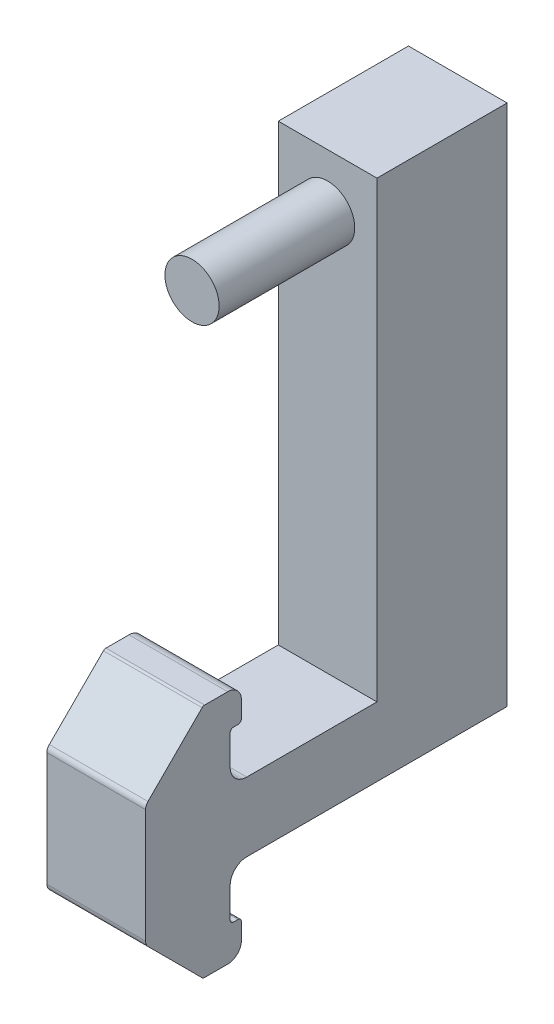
SolidWorks part; units mm, degrees
ref_plane "Front Plane" through (0, 0, 0) normal (0, 0, 1) x (1, 0, 0)
ref_plane "Top Plane" through (0, 0, 0) normal (0, 1, 0) x (1, 0, 0)
ref_plane "Right Plane" through (0, 0, 0) normal (1, 0, 0) x (0, 0, -1)
sketch "Sketch1" plane through (0, 0, 0) normal (0, 0, 1) x (1, 0, 0)
  circle A0 centre (0, 0) radius 2.5
  dimension "D1" = 5
extrude "Boss-Extrude1" add sketch "Sketch1" along normal blind 12.5 contours A0
sketch "Sketch2" plane through (0, 0, 0) normal (0, 0, -1) x (-1, 0, 0)
  line L0 (0, 0) -> (-4.5466, 0) construction
  line L1 (-4.5466, 0) -> (-4.5466, 5)
  line L2 (-4.5466, 5) -> (4.5466, 5)
  line L3 (4.5466, 5) -> (4.5466, 0)
  line L4 (4.5466, 0) -> (0, 0) construction
  line L5 (-4.5466, 0) -> (-4.5466, -40)
  line L6 (-4.5466, -40) -> (4.5466, -40)
  line L7 (4.5466, 0) -> (4.5466, -40)
  circle A0 centre (0, 0) radius 2.5 construction
  dimension "D1" = 5
  dimension "D2" = 40
extrude "Boss-Extrude2" add sketch "Sketch2" along normal blind 12
sketch "Sketch4" plane through (4.5466, 0, 0) normal (1, 0, 0) x (0, 0, -1)
  line L0 (-16.1163, -29.2187) -> (-21.1087, -34.2112)
  line L1 (-15.89, -50.875) -> (-13.76, -50.875)
  line L2 (-21.3319, -34.75) -> (-21.3319, -45.25)
  line L3 (-21.1087, -45.7888) -> (-16.1163, -50.7813)
  line L6 (0, -40) -> (-21.3319, -40) construction
  line L7 (-15.89, -29.125) -> (-13.76, -29.125)
  line L8 (-12.49, -30.395) -> (-12.49, -31.895)
  line L9 (-12.81, -32.215) -> (-13.21, -32.215)
  line L10 (-13.53, -32.535) -> (-13.53, -35.285)
  line L11 (-12, -36.815) -> (0, -36.815)
  line L12 (0, 5) -> (0, -40) construction
  line L13 (-12.49, -49.605) -> (-12.49, -48.105)
  line L14 (-12, -43.185) -> (0, -43.185)
  line L15 (-13.53, -47.465) -> (-13.53, -44.715)
  line L16 (-12.81, -47.785) -> (-13.21, -47.785)
  line L17 (0, -40) -> (0, -36.815)
  line L18 (0, -43.185) -> (12, -43.185)
  line L19 (12, -43.185) -> (12, -40)
  line L20 (12, -40) -> (0, -40)
  line L21 (0, -40) -> (0, -43.185) construction
  arc A0 (-21.1087, -45.7888) -> (-21.3319, -45.25) centre (-20.5699, -45.25) cw
  arc A1 (-21.1087, -34.2112) -> (-21.3319, -34.75) centre (-20.5699, -34.75) ccw
  arc A2 (-15.89, -50.875) -> (-16.1163, -50.7813) centre (-15.89, -50.555) cw
  arc A3 (-16.1163, -29.2187) -> (-15.89, -29.125) centre (-15.89, -29.445) cw
  arc A4 (-13.76, -29.125) -> (-12.49, -30.395) centre (-13.76, -30.395) cw
  arc A5 (-12.49, -31.895) -> (-12.81, -32.215) centre (-12.81, -31.895) cw
  arc A6 (-13.21, -32.215) -> (-13.53, -32.535) centre (-13.21, -32.535) ccw
  arc A7 (-13.53, -35.285) -> (-12, -36.815) centre (-12, -35.285) ccw
  arc A8 (-13.76, -50.875) -> (-12.49, -49.605) centre (-13.76, -49.605) ccw
  arc A9 (-13.53, -44.715) -> (-12, -43.185) centre (-12, -44.715) cw
  arc A10 (-13.21, -47.785) -> (-13.53, -47.465) centre (-13.21, -47.465) cw
  arc A11 (-12.49, -48.105) -> (-12.81, -47.785) centre (-12.81, -48.105) ccw
  point P16 (-16.1163, -74.0955)
  dimension "D1" = 0.762
  dimension "D4" = 0.32
  dimension "D6" = 0.32
  dimension "D7" = 1.27
  dimension "D9" = 0.32
  dimension "D11" = 0.32
  dimension "D12" = 1.53
  dimension "D14" = 21.75
  dimension "D25" = 135
  dimension "D26" = 135
  dimension "D2" = 10.5
  dimension "D5" = 2.13
  dimension "D8" = 1.5
  dimension "D10" = 0.4
  dimension "D13" = 12
  dimension "D18" = 2.75
extrude "Boss-Extrude3" add sketch "Sketch4" against normal up to surface (207.4243 mm away)
